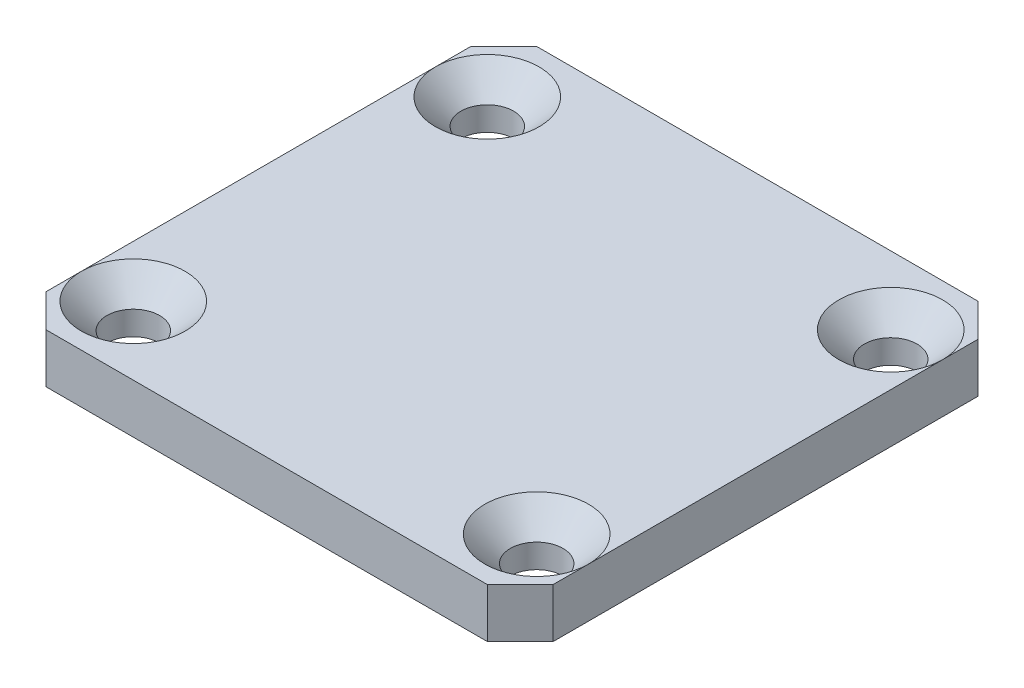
SolidWorks part; units mm, degrees
ref_plane "Front Plane" through (0, 0, 0) normal (0, 0, 1) x (1, 0, 0)
ref_plane "Top Plane" through (0, 0, 0) normal (0, 1, 0) x (1, 0, 0)
ref_plane "Right Plane" through (0, 0, 0) normal (1, 0, 0) x (0, 0, -1)
sketch "Sketch1" plane through (0, 0, 0) normal (0, 1, 0) x (1, 0, 0)
  line L1 (15.4, -14.9) -> (-15.4, -14.9)
  line L2 (15.4, -14.9) -> (15.4, 14.9)
  line L3 (15.4, 14.9) -> (-15.4, 14.9)
  line L4 (-15.4, -14.9) -> (-15.4, 14.9)
  line L5 (15.4, -14.9) -> (-15.4, 14.9) construction
  line L6 (15.4, 14.9) -> (-15.4, -14.9) construction
  point P0 (0, 0)
  dimension "D1" = 30.8
  dimension "D2" = 29.8
extrude "Boss-Extrude1" add sketch "Sketch1" along normal blind 3
chamfer "Chamfer1" distance 2 angle 45 4 edges at (-15.4, 1.5, -14.9) (15.4, 1.5, -14.9) (15.4, 1.5, 14.9) (-15.4, 1.5, 14.9)
hole_wizard "CSK for M3 Flat Head Machine Screw1" positions "Sketch11" profile "Sketch10" countersink size "M3" standard "ANSI Metric"
sketch "Sketch11" plane through (16.1594, 3, 3.7896) normal (0, 1, 0) x (-1, 0, 0)
  line L0 (16.1594, -2.0433) -> (16.1594, -5.5358) construction
  line L1 (17.9056, -3.7896) -> (14.4131, -3.7896) construction
  point P0 (28.4094, 6.9604)
  dimension "D1" = 12.25
  dimension "D2" = 10.75
sketch "Sketch10" plane through (-12.25, 3, 10.75) normal (1, 0, 0) x (0, 0, 1)
  line L0 (0, 0) -> (0, 3)
  line L1 (0, 3) -> (1.6, 3)
  line L2 (1.6, 3) -> (1.6, 1.55)
  line L3 (1.6, 1.55) -> (3.15, 0)
  line L5 (3.15, 0) -> (0, 0)
  line L6 (-1.6, 1.55) -> (-3.15, 0) construction
  line L11 (0, -6.35) -> (0, 107.95) construction
  dimension "Thru Hole Dia." = 3.2
  dimension "Thru Hole Depth" = 3
  dimension "Near C'Sink Dia." = 6.3
  dimension "Near C'Sink Angle" = 90
pattern_linear "LPattern1" count 2 spacing 24.5 along (1, 0, 0) count 2 spacing 21.5 along (0, 0, -1) of "CSK for M3 Flat Head Machine Screw1"
